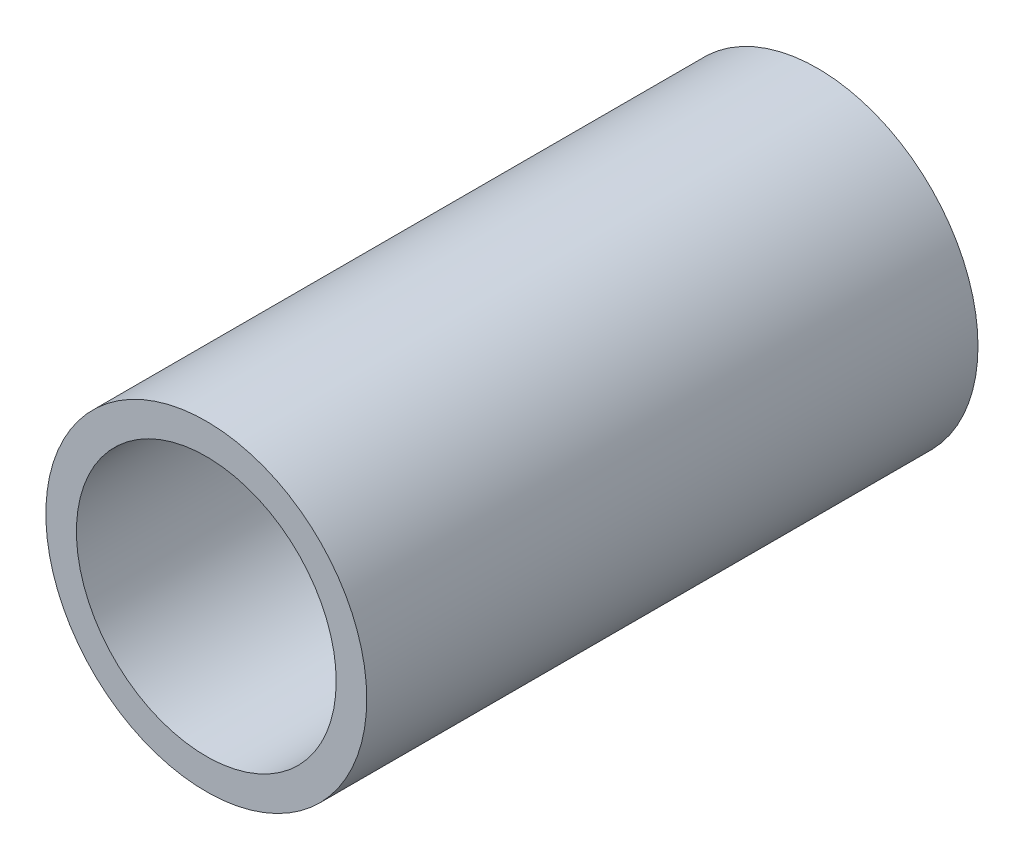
SolidWorks part; units mm, degrees
ref_plane "Front" through (0, 0, 0) normal (0, 0, 1) x (1, 0, 0)
ref_plane "Top" through (0, 0, 0) normal (0, 1, 0) x (1, 0, 0)
ref_plane "Right" through (0, 0, 0) normal (1, 0, 0) x (0, 0, -1)
sketch "Sketch1" plane through (0, 0, 0) normal (0, 0, 1) x (1, 0, 0)
  circle A0 centre (0, 0) radius 26.9875
  circle A1 centre (0, 0) radius 33.3375
  dimension "D1" = 53.975
  dimension "D2" = 66.675
extrude "Boss-Extrude1" add sketch "Sketch1" along normal blind 127
